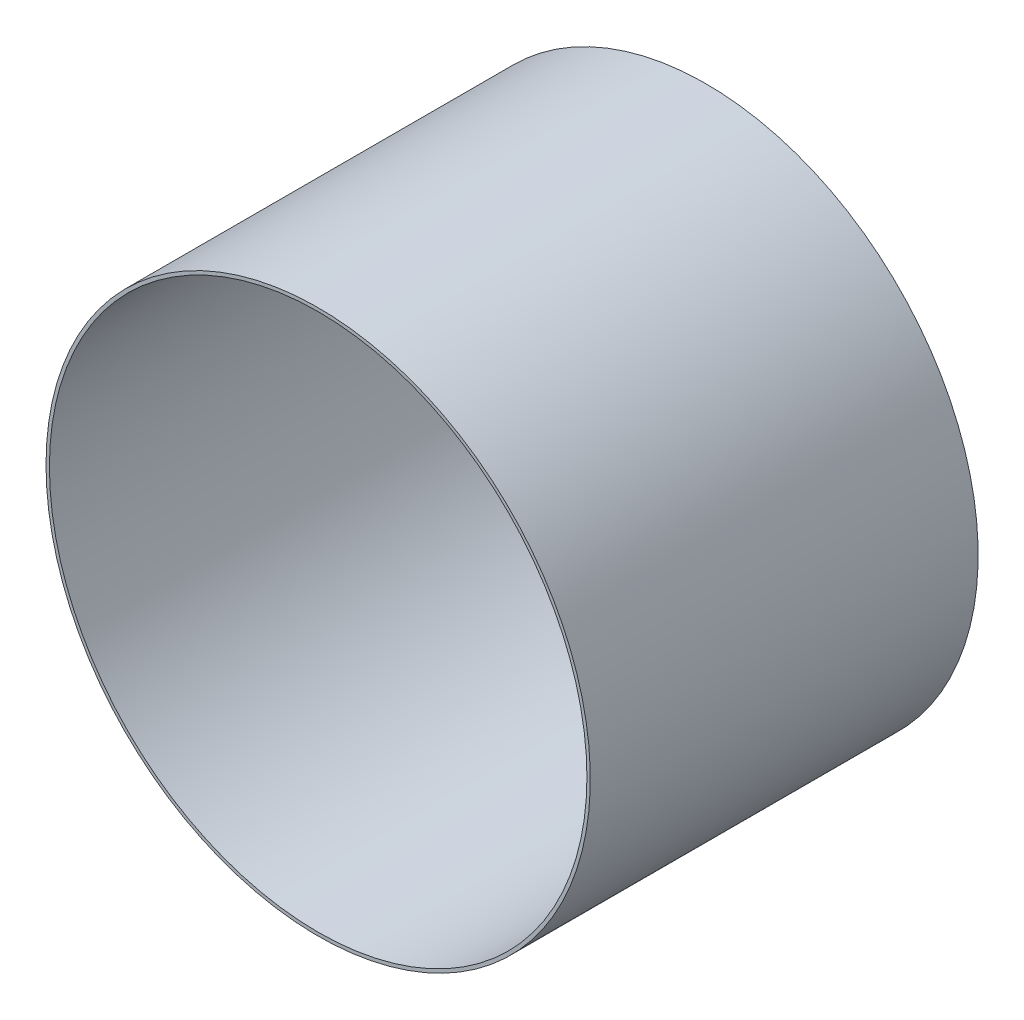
SolidWorks part; units mm, degrees
ref_plane "Front Plane" through (0, 0, 0) normal (0, 0, 1) x (1, 0, 0)
ref_plane "Top Plane" through (0, 0, 0) normal (0, 1, 0) x (1, 0, 0)
ref_plane "Right Plane" through (0, 0, 0) normal (1, 0, 0) x (0, 0, -1)
sketch "Sketch1" plane through (0, 0, 0) normal (0, 0, 1) x (1, 0, 0)
  circle A0 centre (0, 0) radius 160
  circle A1 centre (0, 0) radius 158
  dimension "D1" = 320
  dimension "D2" = 2
extrude "Boss-Extrude1" add sketch "Sketch1" along normal blind 228
